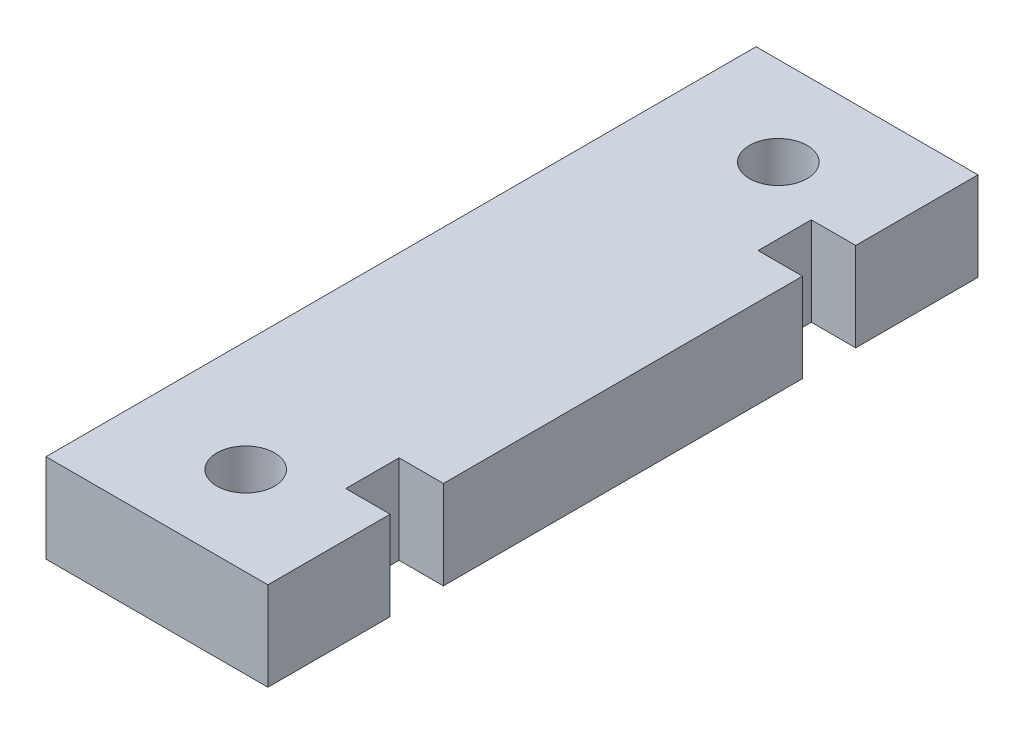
SolidWorks part; units mm, degrees
ref_plane "Plan de face" through (0, 0, 0) normal (0, 0, 1) x (1, 0, 0)
ref_plane "Plan de dessus" through (0, 0, 0) normal (0, 1, 0) x (1, 0, 0)
ref_plane "Plan de droite" through (0, 0, 0) normal (1, 0, 0) x (0, 0, -1)
sketch "Esquisse1" plane through (0, 0, 0) normal (0, 0, 1) x (1, 0, 0)
  line L1 (0, 0) -> (25, 0)
  line L2 (0, 0) -> (0, 10)
  line L3 (0, 10) -> (25, 10)
  line L4 (25, 0) -> (25, 10)
  dimension "D1" = 25
  dimension "D2" = 10
extrude "Extrusion1" add sketch "Esquisse1" against normal blind 80
sketch "Esquisse2" plane through (0, 10, 0) normal (0, 1, 0) x (-1, 0, 0)
  line L0 (-12.5, -79.6517) -> (-12.5, 6.5908) construction
  line L1 (5.7137, -40) -> (-30.8693, -40) construction
  line L2 (-25, -80) -> (0, -80) construction
  circle A0 centre (-12.5, -70) radius 3.25
  circle A1 centre (-12.5, -10) radius 3.25
  dimension "D1" = 6.5
  dimension "D2" = 10
extrude "Enlèv. mat.-Extru.1" cut sketch "Esquisse2" against normal blind 10
ref_plane "Plan1" through (25, 10, 0) normal (0, 0, 1) x (1, 0, 0)
sketch "Esquisse9" plane through (25, 0, 0) normal (1, 0, 0) x (0, 0, -1)
  line L0 (40, 12.7698) -> (40, -2.5079) construction
  line L1 (80, 10) -> (0, 10) construction
  line L2 (13.7763, 10) -> (19.7763, 10)
  line L3 (13.7763, 10) -> (13.7763, 0)
  line L4 (13.7763, 0) -> (19.7763, 0)
  line L5 (19.7763, 10) -> (19.7763, 0)
  line L6 (80, 0) -> (0, 0) construction
  line L7 (60.2237, 10) -> (60.2237, 0)
  line L8 (66.2237, 0) -> (60.2237, 0)
  line L9 (66.2237, 10) -> (66.2237, 0)
  line L10 (66.2237, 10) -> (60.2237, 10)
  dimension "D1" = 6
extrude "Enlèv. mat.-Extru.4" cut sketch "Esquisse9" against normal blind 5
